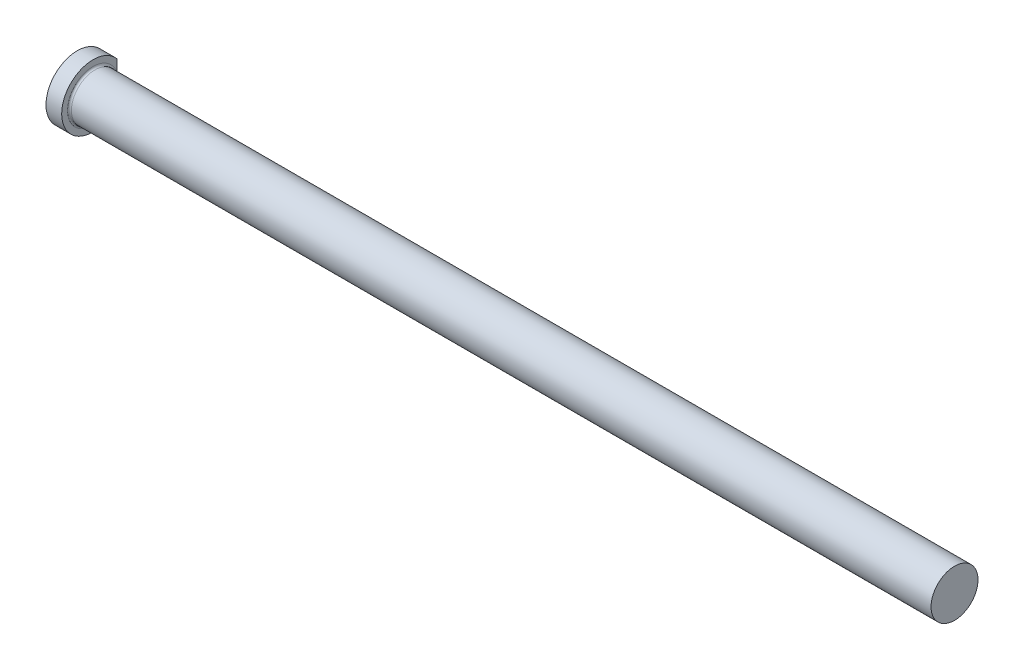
SolidWorks part; units mm, degrees
ref_plane "Front Plane" through (0, 0, 0) normal (0, 0, 1) x (1, 0, 0)
ref_plane "Top Plane" through (0, 0, 0) normal (0, 1, 0) x (1, 0, 0)
ref_plane "Right Plane" through (0, 0, 0) normal (1, 0, 0) x (0, 0, -1)
sketch "Sketch1" plane through (0, 0, 0) normal (0, 0, 1) x (1, 0, 0)
  line L0 (0, 0) -> (0, 12.7)
  line L1 (0, 12.7) -> (6.35, 12.7)
  line L2 (6.35, 12.7) -> (6.35, 10.3061)
  line L3 (7.1374, 9.5186) -> (355.6, 9.5186)
  line L4 (355.6, 9.5186) -> (355.6, 0)
  line L5 (355.6, 0) -> (0, 0)
  line L6 (355.6, 0) -> (0, 0) construction
  line L7 (0, 0) -> (-10.4771, 0) construction
  line L8 (355.6, 0) -> (1002.3976, 0) construction
  line L9 (7.1374, 9.5186) -> (-7.9138, 9.5186) construction
  arc A0 (7.1374, 9.5186) -> (6.35, 10.3061) centre (7.1374, 10.3061) cw
  dimension "D1" = 0.7874
  dimension "HeadDia" = 25.4
  dimension "HeadThickness" = 6.35
  dimension "PinDia" = 19.0373
  dimension "overall" = 355.6
revolve "PIN" add sketch "Sketch1" angle 360 about L6
ref_plane "Plane1" through (181.3687, 0, -9.5186) normal (0, 0, -1) x (0, -1, 0)
ref_plane "CutPlane" through (0, 0, -9.6964) normal (0, 0, -1) x (-1, 0, 0)
other "SurfaceCut1"
